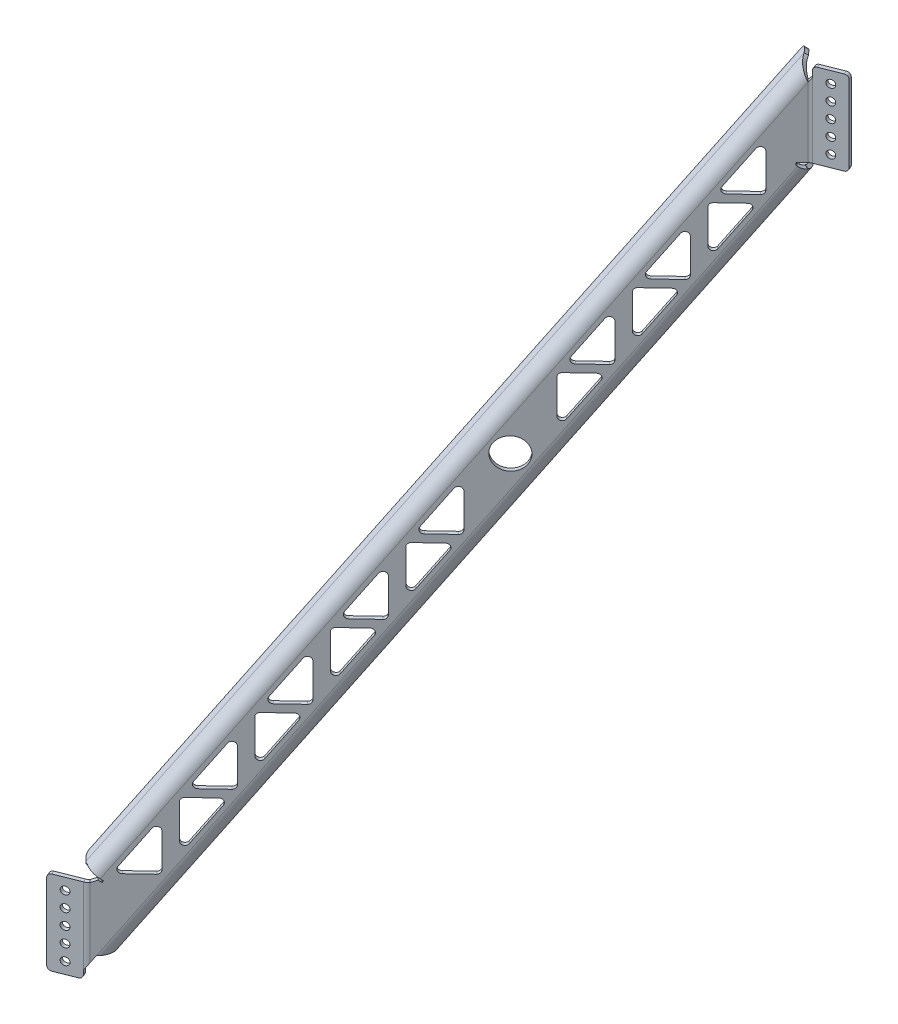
SolidWorks part; units mm, degrees
other "<Lift Brace>-<Cut-Extrude6>" parameters "Thickness"=3.175
ref_plane "Front Plane" through (0, 0, 0) normal (0, 0, 1) x (1, 0, 0)
ref_plane "Top Plane" through (0, 0, 0) normal (0, 1, 0) x (1, 0, 0)
ref_plane "Right Plane" through (0, 0, 0) normal (1, 0, 0) x (0, 0, -1)
mirrored part "Lift Brace_Mirrored"
sheet metal parameters "Sheet-Metal1" thickness 3.175 parameters "D1"=7.0104
convert to sheet metal "Convert-Solid1" parameters "D1"=7.0104
bend "RoundBend1" bend radius 7 bend angle 21.65 parameters "D5"=1
bend "RoundBend2" bend radius 7 bend angle 90 parameters "D5"=2
bend "RoundBend3" bend radius 7 bend angle 21.65 parameters "D5"=3
bend "RoundBend4" bend radius 7 bend angle 90 parameters "D5"=4
flat pattern "Flat-Pattern1"
sketch "Bend-Lines1" plane through (-0.9151, 0, -0.9711) normal (0.6858, 0, 0.7278) x (0.7278, 0, -0.6858)
  line L0 (1.2179, 0.4378) -> (422.418, 589.6105) construction
  line L1 (423.8041, 582.6013) -> (423.8041, 519.938) construction
  line L2 (421.9213, 513.7655) -> (11.9812, -59.6567) construction
  line L3 (-1.0808, -66.7891) -> (-1.0808, -6.35) construction
sketch3d "Bounding-Box1" [suppressed]
  line L0 (417.6021, 610.3264, 0) -> (-58.0141, -52.1549, 0) construction
  line L1 (479.7021, 565.7429, 0) -> (4.0859, -96.7384, 0) construction
  line L2 (417.6021, 610.3264, 0) -> (479.7021, 565.7429, 0) construction
  line L3 (-58.0141, -52.1549, 0) -> (4.0859, -96.7384, 0) construction
